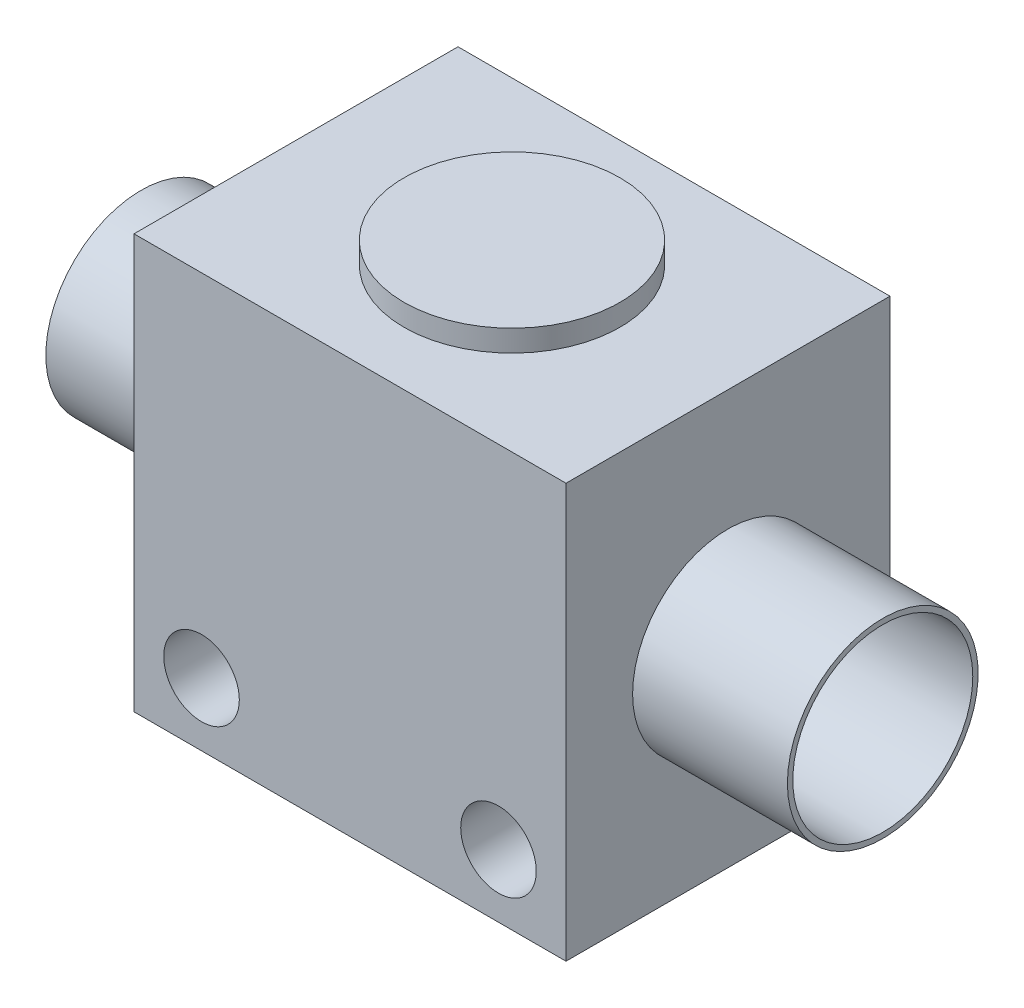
SolidWorks part; units mm, degrees
ref_plane "Front" through (0, 0, 0) normal (0, 0, 1) x (1, 0, 0)
ref_plane "Top" through (0, 0, 0) normal (0, 1, 0) x (1, 0, 0)
ref_plane "Right" through (0, 0, 0) normal (1, 0, 0) x (0, 0, -1)
sketch "Base Sketch" plane through (0, 0, 0) normal (0, 0, 1) x (1, 0, 0)
  line L0 (0, -11) -> (0, -6.0564) construction
  line L1 (-12, -11) -> (12, -11)
  line L2 (-12, -11) -> (-12, 12)
  line L3 (-12, 12) -> (12, 12)
  line L4 (12, -11) -> (12, 12)
  dimension "Q" = 11
  dimension "Width" = 24
  dimension "Height" = 23
extrude "Base" add sketch "Base Sketch" along normal mid plane 18
sketch "A Port Boss Sketch" plane through (12, 0, 0) normal (1, 0, 0) x (0, 0, -1)
  circle A0 centre (0, 0) radius 5.3
  dimension "Boss Dia." = 10.6
extrude "A Port Boss" add sketch "A Port Boss Sketch" along normal blind 8.6
sketch "A Port Fitting Cut Sketch" plane through (20.6, 0, 0) normal (1, 0, 0) x (0, 0, -1)
  circle A0 centre (0, 0) radius 5
  dimension "Diameter" = 10
extrude "A Port Fitting Cut" cut sketch "A Port Fitting Cut Sketch" against normal blind 10
sketch "P Port Boss Sketch" plane through (-12, 0, 0) normal (-1, 0, 0) x (0, 0, 1)
  circle A0 centre (0, 0) radius 5.3
  dimension "Diameter" = 10.6
extrude "P Port Boss" add sketch "P Port Boss Sketch" along normal blind 8.6
sketch "P Port Fitting Cut Sketch" plane through (-20.6, 0, 0) normal (-1, 0, 0) x (0, 0, 1)
  circle A0 centre (0, 0) radius 5
  dimension "Diameter" = 10
extrude "P Port Fitting Cut" cut sketch "P Port Fitting Cut Sketch" against normal blind 10
sketch "Knob Base Sketch" plane through (0, 12, 0) normal (0, 1, 0) x (-1, 0, 0)
  circle A0 centre (0, 0) radius 6
  dimension "D1" = 12
extrude "Knob Base" add sketch "Knob Base Sketch" along normal blind 1.2
sketch "Mounting Holes Sketch" plane through (0, 0, 9) normal (0, 0, 1) x (1, 0, 0)
  line L0 (0, 0) -> (0, -17.5957) construction
  line L1 (-12, -11) -> (12, -11) construction
  circle A0 centre (-8.25, -7.5) radius 2.1
  circle A1 centre (8.25, -7.5) radius 2.1
  dimension "D1" = 4.2
  dimension "L5" = 16.5
  dimension "L6" = 3.5
extrude "Mounting Holes" cut sketch "Mounting Holes Sketch" against normal through all
